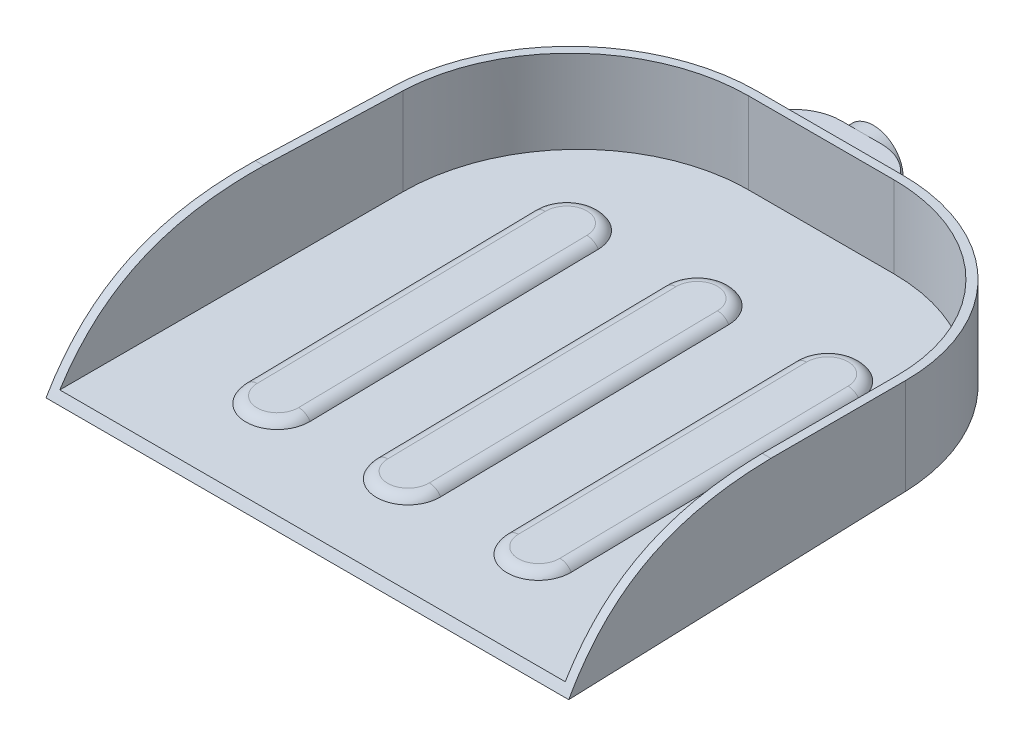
SolidWorks part; units mm, degrees
ref_plane "Front Plane" through (0, 0, 0) normal (0, 0, 1) x (1, 0, 0)
ref_plane "Top Plane" through (0, 0, 0) normal (0, 1, 0) x (1, 0, 0)
ref_plane "Right Plane" through (0, 0, 0) normal (1, 0, 0) x (0, 0, -1)
sketch "Sketch1" plane through (0, 0, 0) normal (0, 0, 1) x (1, 0, 0)
  line L1 (-152.5, -31.5) -> (152.5, -31.5)
  line L2 (-152.5, -31.5) -> (-152.5, 31.5)
  line L3 (-152.5, 31.5) -> (152.5, 31.5)
  line L4 (152.5, -31.5) -> (152.5, 31.5)
  line L5 (-152.5, -31.5) -> (152.5, 31.5) construction
  line L6 (-152.5, 31.5) -> (152.5, -31.5) construction
  point P0 (0, 0)
  dimension "D1" = 305
  dimension "D2" = 63
extrude "Extrude1" add sketch "Sketch1" against normal blind 304.8 draft 1
sketch "Sketch2" plane through (0, 0, -1.3298) normal (1, 0, 0) x (0, 0, -1)
  line L0 (303.4702, 26.1797) -> (-1.3298, 31.5) construction
  line L1 (118.7015, 29.4048) -> (357.9425, 29.4048)
  spline S0 degree 3 poles (-1.3298, -31.5) (24.575, 14.2672) (64.2789, 29.4048) (118.7015, 29.4048) knots 0 0 0 0 1 1 1 1
  point P12 (303.4702, 26.1797)
extrude "Extrude2" cut sketch "Sketch2" against normal through all and the other way through all
fillet "Fillet1" radius 106.68 2 edges at (-147.1797, 0, -304.8) (147.1797, 0, -304.8)
sketch "Sketch3" plane through (0, -31.4904, -0.5497) normal (0, -0.9998, -0.0175) x (1, 0, 0)
  line L0 (0, -58.6355) -> (0, -226.791) construction
  line L1 (14.678, -58.6355) -> (14.678, -226.791)
  line L2 (-14.678, -58.6355) -> (-14.678, -226.791)
  line L3 (76.2, -58.6355) -> (76.2, -226.791) construction
  line L4 (90.878, -58.6355) -> (90.878, -226.791)
  line L5 (61.522, -58.6355) -> (61.522, -226.791)
  line L6 (-76.2, -58.6355) -> (-76.2, -226.791) construction
  line L7 (-61.522, -58.6355) -> (-61.522, -226.791)
  line L8 (-90.878, -58.6355) -> (-90.878, -226.791)
  arc A0 (14.678, -58.6355) -> (-14.678, -58.6355) centre (0, -58.6355) ccw
  arc A1 (-14.678, -226.791) -> (14.678, -226.791) centre (0, -226.791) ccw
  arc A2 (90.878, -58.6355) -> (61.522, -58.6355) centre (76.2, -58.6355) ccw
  arc A3 (61.522, -226.791) -> (90.878, -226.791) centre (76.2, -226.791) ccw
  arc A4 (-61.522, -58.6355) -> (-90.878, -58.6355) centre (-76.2, -58.6355) ccw
  arc A5 (-90.878, -226.791) -> (-61.522, -226.791) centre (-76.2, -226.791) ccw
  point P3 (0, -142.7132)
  point P10 (76.2, -142.7132)
  point P17 (-76.2, -142.7132)
extrude "Extrude3" cut sketch "Sketch3" against normal blind 3.81
fillet "Fillet3" radius 2.54 12 edges at (90.878, -25.1903, -143.1747) (76.2, -23.4668, -241.9153) (61.522, -25.1903, -143.1747) (76.2, -26.9138, -44.434) (14.678, -25.1903, -143.1747) (0, -23.4668, -241.9153) (-14.678, -25.1903, -143.1747) (0, -26.9138, -44.434) (-61.522, -25.1903, -143.1747) (-76.2, -23.4668, -241.9153) (-90.878, -25.1903, -143.1747) (-76.2, -26.9138, -44.434)
shell "Shell1" thickness 5
sketch "Sketch4" plane through (0, 0, -304.8) normal (0, 0, -1) x (-1, 0, 0)
  line L1 (-37.808, 13.1475) -> (37.808, 13.1475) construction
  line L2 (-37.808, 13.1475) -> (37.808, 13.1475)
  line L3 (-37.808, -13.1475) -> (37.808, -13.1475) construction
  line L4 (-37.808, 13.1475) -> (-37.808, 17.4131)
  line L5 (-37.808, 13.1475) -> (37.808, -13.1475) construction
  line L6 (-37.808, -13.1475) -> (37.808, 13.1475) construction
  line L7 (-37.808, 17.4131) -> (37.808, 17.4131)
  line L8 (37.808, 13.1475) -> (37.808, 17.4131)
  line L9 (-37.808, -13.1475) -> (37.808, -13.1475)
  line L10 (-37.808, -13.1475) -> (-37.808, -17.4131)
  line L11 (-37.808, -17.4131) -> (37.808, -17.4131)
  line L12 (37.808, -13.1475) -> (37.808, -17.4131)
  point P0 (0, 0)
extrude "Extrude4" add sketch "Sketch4" along normal blind 18.288
sketch "Sketch5" plane through (0, 0, -304.8) normal (0, 0, -1) x (-1, 0, 0)
  line L0 (37.808, 17.4131) -> (-37.808, 17.4131) construction
  circle A0 centre (0, 0) radius 17.4131
  circle A1 centre (0, 0) radius 13.1475
extrude "Extrude5" add sketch "Sketch5" along normal blind 25.4
fillet "Fillet4" radius 27.94 4 edges at (-37.808, -15.2803, -323.088) (37.808, -15.2803, -323.088) (-37.808, 15.2803, -323.088) (37.808, 15.2803, -323.088)
